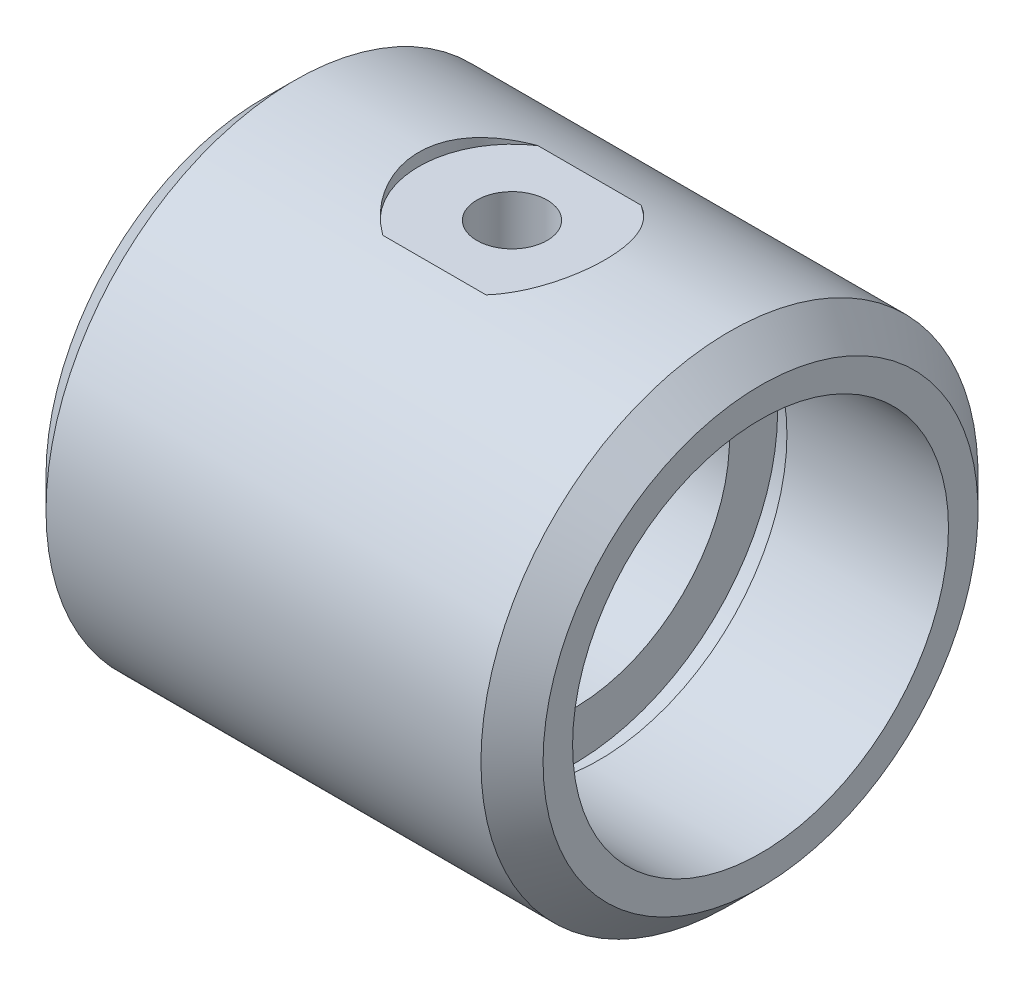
SolidWorks part; units mm, degrees
ref_plane "Front Plane" through (0, 0, 0) normal (0, 0, 1) x (1, 0, 0)
ref_plane "Top Plane" through (0, 0, 0) normal (0, 1, 0) x (1, 0, 0)
ref_plane "Right Plane" through (0, 0, 0) normal (1, 0, 0) x (0, 0, -1)
sketch "Sketch1" plane through (0, 0, 0) normal (0, 1, 0) x (1, 0, 0)
  line L0 (-15.8114, 0) -> (20.3599, 0) construction
  line L1 (-2, 6.05) -> (-2, 5)
  line L2 (-2, 5) -> (2, 5)
  line L3 (2, 5) -> (2, 6.05)
  line L4 (2, 6.05) -> (8, 6.05)
  line L5 (-2, 6.05) -> (-8, 6.05)
  line L6 (-8, 6.05) -> (-8, 7)
  line L7 (-7, 8) -> (7, 8)
  line L8 (8, 7) -> (8, 6.05)
  line L9 (-8, 7) -> (-7, 8)
  line L10 (7, 8) -> (8, 7)
  point P10 (-8, 8)
  point P11 (8, 8)
  dimension "D1" = 6.05
  dimension "D2" = 4
  dimension "D3" = 8
  dimension "D4" = 6
  dimension "D5" = 6
  dimension "D6" = 5
  dimension "D7" = 2
revolve "Revolve1" add sketch "Sketch1" angle 360 about L0
ref_plane "Plane1" through (0, 8, 0) normal (0, 1, 0) x (-1, 0, 0)
hole_wizard "#43 (0.089) Diameter Hole1" positions "Sketch3" profile "Sketch2" hole size "#43" standard "Ansi Inch"
sketch "Sketch3" plane through (0, 8, 0) normal (0, 1, 0) x (-1, 0, 0)
  point P0 (0, 0)
sketch "Sketch2" plane through (0, 8, 0) normal (1, 0, 0) x (0, 0, 1)
  line L0 (0, 0) -> (0, 5.7592)
  line L1 (0, 5.7592) -> (1.1303, 5.08)
  line L2 (1.1303, 5.08) -> (1.1303, 0)
  line L5 (1.1303, 0) -> (0, 0)
  line L10 (0, 5.7592) -> (-1.1303, 5.08) construction
  line L11 (0, -6.35) -> (0, 107.95) construction
  dimension "Hole Dia." = 2.2606
  dimension "Hole Depth" = 5.08
  dimension "Drill Angle" = 118
sketch "Sketch4" plane through (0, 8, 0) normal (0, 1, 0) x (-1, 0, 0)
  circle A0 centre (0, 0) radius 3
  dimension "D1" = 6
extrude "Cut-Extrude1" cut sketch "Sketch4" against normal blind 0.4
sketch "Sketch5" plane through (-2, 0, 0) normal (-1, 0, 0) x (0, 0, 1)
  circle A0 centre (0, 0) radius 6.05 construction
  circle A1 centre (0, 0) radius 6.05
  circle A2 centre (0, 0) radius 6.55
  dimension "D1" = 0.5
extrude "Cut-Extrude2" cut sketch "Sketch5" along normal blind 0.8
sketch "Sketch6" plane through (2, 0, 0) normal (1, 0, 0) x (0, 0, -1)
  circle A0 centre (0, 0) radius 6.05 construction
  circle A1 centre (0, 0) radius 6.05
  circle A2 centre (0, 0) radius 6.55
  dimension "D1" = 0.5
extrude "Cut-Extrude3" cut sketch "Sketch6" along normal blind 0.8
